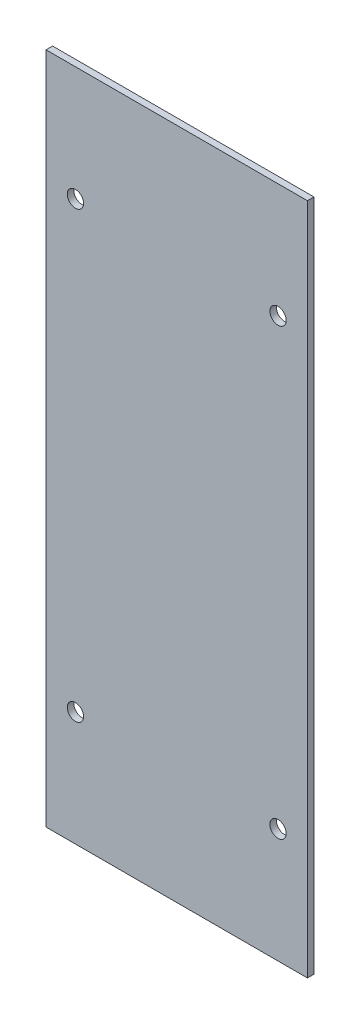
SolidWorks part; units mm, degrees
ref_plane "前视基准面" through (0, 0, 0) normal (0, 0, 1) x (1, 0, 0)
ref_plane "上视基准面" through (0, 0, 0) normal (0, 1, 0) x (1, 0, 0)
ref_plane "右视基准面" through (0, 0, 0) normal (1, 0, 0) x (0, 0, -1)
other "Configuration Table"
sketch "草图1" plane through (0, 0, 0) normal (0, 0, 1) x (1, 0, 0)
  line L0 (0, 0) -> (-84.1841, 0) construction
  line L2 (40, -103) -> (-40, -103)
  line L3 (40, -103) -> (40, 103)
  line L4 (40, 103) -> (-40, 103)
  line L5 (-40, -103) -> (-40, 103)
  line L6 (40, -103) -> (-40, 103) construction
  line L7 (40, 103) -> (-40, -103) construction
  line L8 (-31, -68) -> (31, -68) construction
  line L9 (-31, -68) -> (-31, 68) construction
  line L10 (-31, 68) -> (31, 68) construction
  line L11 (31, -68) -> (31, 68) construction
  line L12 (-31, -68) -> (31, 68) construction
  line L13 (-31, 68) -> (31, -68) construction
  circle A0 centre (-31, 68) radius 2.5
  circle A1 centre (31, 68) radius 2.5
  circle A2 centre (-31, -68) radius 2.5
  circle A3 centre (31, -68) radius 2.5
  dimension "D5" = 5
  dimension "D1" = 80
  dimension "D2" = 206
  dimension "D3" = 62
  dimension "D4" = 136
extrude "凸台-拉伸1" add sketch "草图1" along normal blind 2
